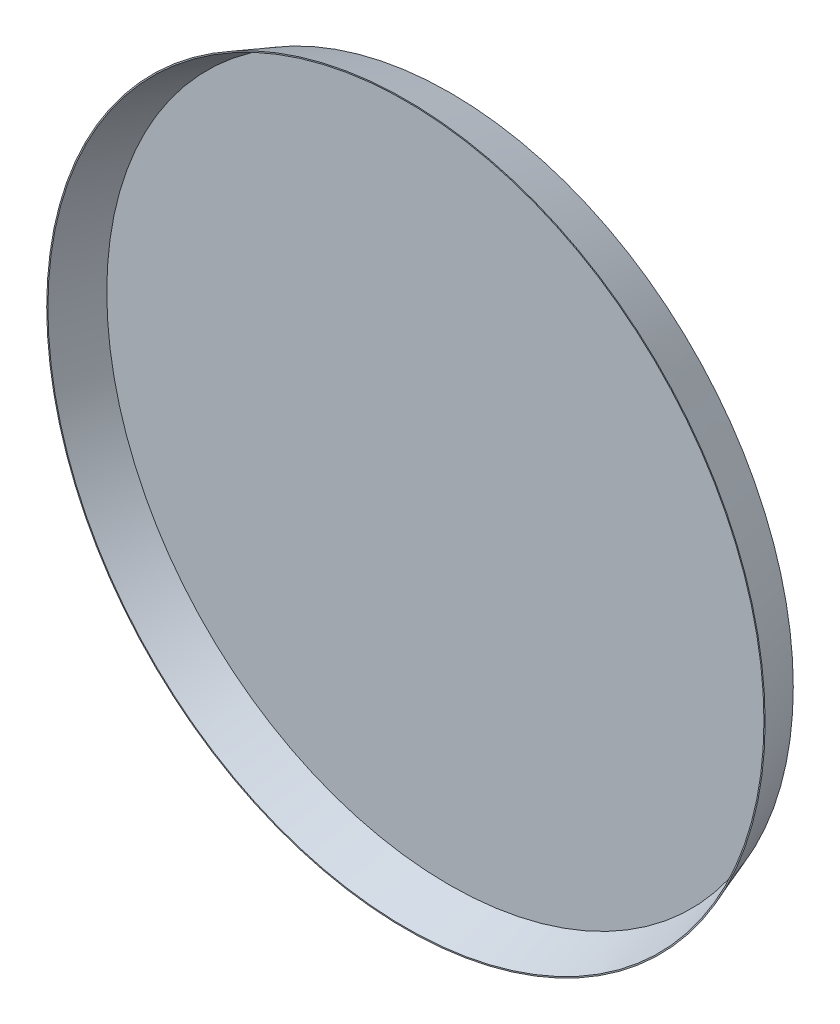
SolidWorks part; units mm, degrees
ref_plane "Front" through (0, 0, 0) normal (0, 0, 1) x (1, 0, 0)
ref_plane "Top" through (0, 0, 0) normal (0, 1, 0) x (1, 0, 0)
ref_plane "Right" through (0, 0, 0) normal (1, 0, 0) x (0, 0, -1)
sketch "Sketch1" plane through (0, 0, 0) normal (0, 0, 1) x (1, 0, 0)
  circle A0 centre (0, 0) radius 15.5
  dimension "D1" = 31
extrude "Base-Extrude" add sketch "Sketch1" along normal blind 2 draft 20
shell "Shell1" thickness 0.05
sketch "Sketch2" plane through (0, 0, 0.05) normal (0, 0, 1) x (1, 0, 0)
  line L0 (-19.075, 0) -> (20.9062, 0) construction
  line L1 (0, 17.0302) -> (0, -17.1523) construction
  circle A0 centre (10, 0) radius 1.75
  circle A1 centre (-7.5, 0) radius 4.05
  circle A2 centre (0, 7.5) radius 4.05
  circle A3 centre (0, -7.5) radius 4.05
  circle A4 centre (0, 0) radius 0.5
  dimension "D1" = 8.1
  dimension "D2" = 8.1
  dimension "D3" = 8.1
  dimension "D4" = 3.5
  dimension "D5" = 10
  dimension "D6" = 7.5
  dimension "D7" = 7.5
  dimension "D8" = 7.5
  dimension "D9" = 1
extrude "Cut-Extrude1" [suppressed] cut sketch "Sketch2" against normal through all
sketch "Sketch4" plane through (0, 0, 0.05) normal (0, 0, 1) x (1, 0, 0)
  line L0 (0, 0) -> (20, 0) construction
  line L1 (0, 0) -> (17.3205, -10) construction
  line L2 (0, 0) -> (10, -17.3205) construction
  line L3 (0, 0) -> (0, -20) construction
  line L4 (0, 0) -> (-10, -17.3205) construction
  line L5 (0, 0) -> (-17.3205, -10) construction
  line L6 (0, 0) -> (-20, 0) construction
  line L7 (0, 0) -> (-17.3205, 10) construction
  line L8 (0, 0) -> (-10, 17.3205) construction
  line L9 (0, 0) -> (0, 20) construction
  line L10 (0, 0) -> (10, 17.3205) construction
  line L11 (0, 0) -> (17.3205, 10) construction
  circle A0 centre (0, 0) radius 10
  dimension "D1" = 20
  dimension "D2" = 20
sketch "Sketch5" [suppressed] plane through (0, 0, 0.05) normal (0, 0, 1) x (1, 0, 0)
  circle A0 centre (-7.5, 0) radius 0.095
  circle A1 centre (0, -7.5) radius 0.095
  circle A2 centre (0, 7.5) radius 0.095
extrude "Cut-Extrude2" [suppressed] cut sketch "Sketch5" against normal through all
